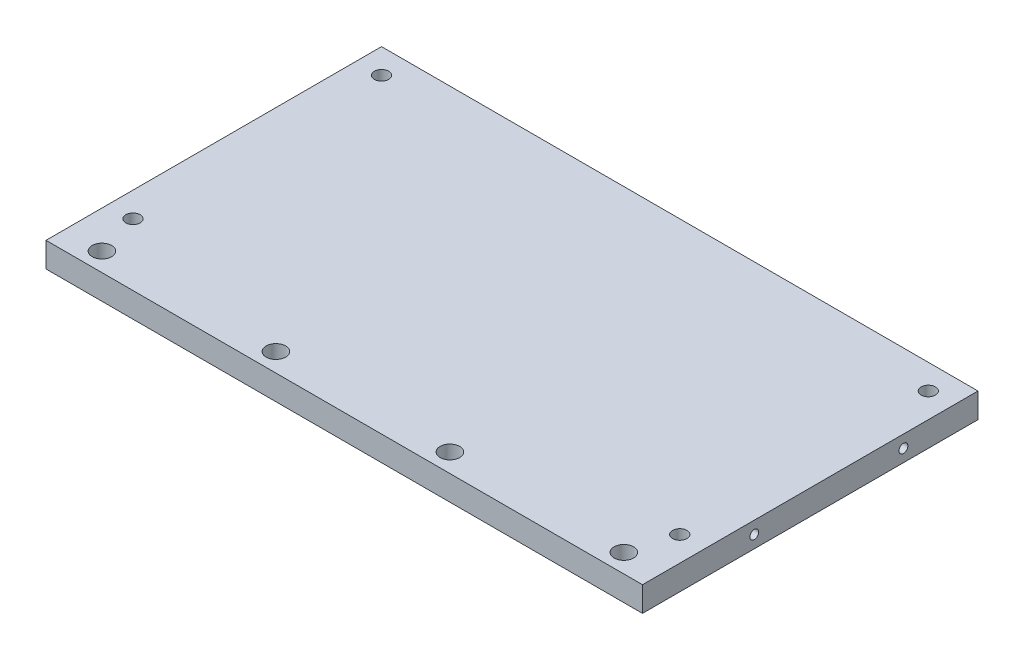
SolidWorks part; units mm, degrees
ref_plane "Front Plane" through (0, 0, 0) normal (0, 0, 1) x (1, 0, 0)
ref_plane "Top Plane" through (0, 0, 0) normal (0, 1, 0) x (1, 0, 0)
ref_plane "Right Plane" through (0, 0, 0) normal (1, 0, 0) x (0, 0, -1)
sketch "Sketch1" plane through (0, 0, 0) normal (0, 1, 0) x (1, 0, 0)
  line L1 (0, 0) -> (152.4, 0)
  line L2 (0, 0) -> (0, 85.725)
  line L3 (0, 85.725) -> (152.4, 85.725)
  line L4 (152.4, 0) -> (152.4, 85.725)
  dimension "D1" = 85.725
  dimension "D2" = 152.4
extrude "Extrude1" add sketch "Sketch1" along normal blind 6.35
sketch "Sketch2" plane through (0, 6.35, 0) normal (0, 1, 0) x (-1, 0, 0)
  line L0 (-152.4, -85.725) -> (0, -85.725) construction
  line L1 (0, -85.725) -> (0, 0) construction
  line L2 (-6.35, -79.375) -> (-146.05, -79.375) construction
  line L3 (-6.35, -79.375) -> (-6.35, -15.875) construction
  circle A0 centre (-6.35, -79.375) radius 1.8288
  circle A1 centre (-146.05, -79.375) radius 1.8288
  circle A2 centre (-6.35, -15.875) radius 1.8288
  circle A3 centre (-146.05, -15.875) radius 1.8288
  dimension "D1" = 3.6576
  dimension "D4" = 90
  dimension "D2" = 6.35
  dimension "D3" = 6.35
extrude "Cut-Extrude1" cut sketch "Sketch2" against normal through all
sketch "Sketch3" plane through (0, 6.35, 0) normal (0, 1, 0) x (-1, 0, 0)
  line L0 (0, 0) -> (-152.4, 0) construction
  line L1 (0, -85.725) -> (0, 0) construction
  circle A0 centre (-9.525, -4.7625) radius 2.4892
  circle A1 centre (-53.975, -4.7625) radius 2.4892
  circle A2 centre (-98.425, -4.7625) radius 2.4892
  circle A3 centre (-142.875, -4.7625) radius 2.4892
  dimension "D1" = 4.9784
  dimension "D2" = 4.7625
  dimension "D3" = 9.525
extrude "Cut-Extrude2" cut sketch "Sketch3" against normal through all
sketch "Sketch4" plane through (152.4, 0, 0) normal (1, 0, 0) x (0, 0, -1)
  line L0 (0, 6.35) -> (0, 0) construction
  line L2 (0, 0) -> (85.725, 0) construction
  circle A0 centre (28.575, 3.175) radius 1.1303
  circle A1 centre (66.675, 3.175) radius 1.1303
  point P2 (0, 3.175)
  dimension "D1" = 2.2606
  dimension "D3" = 3.175
  dimension "D4" = 38.1
  dimension "D2" = 28.575
extrude "Cut-Extrude3" cut sketch "Sketch4" against normal blind 12.7
sketch "Sketch5" plane through (0, 0, -85.725) normal (0, 0, -1) x (-1, 0, 0)
  line L0 (-152.4, 0) -> (0, 0) construction
  circle A0 centre (-142.875, 3.175) radius 1.1303
  circle A1 centre (-98.425, 3.175) radius 1.1303
  circle A2 centre (-53.975, 3.175) radius 1.1303
  circle A3 centre (-9.525, 3.175) radius 1.1303
  dimension "D1" = 2.2606
  dimension "D2" = 3.175
  dimension "D3" = 9.525
extrude "Cut-Extrude4" cut sketch "Sketch5" against normal blind 12.7
sketch "Sketch6" plane through (0, 0, 0) normal (-1, 0, 0) x (0, 0, 1)
  circle A0 centre (-66.675, 3.175) radius 1.1303
  circle A1 centre (-28.575, 3.175) radius 1.1303
  dimension "D1" = 2.2606
  dimension "D2" = 2.2606
extrude "Cut-Extrude5" cut sketch "Sketch6" against normal blind 12.7
